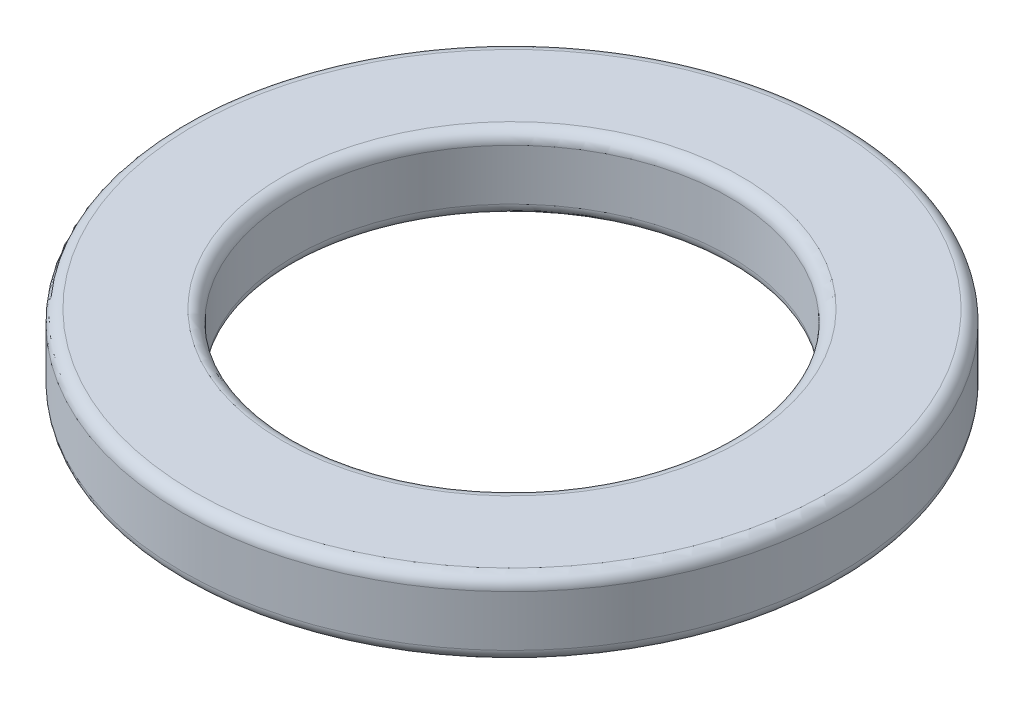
SolidWorks part; units mm, degrees
ref_plane "Face" through (0, 0, 0) normal (0, 0, 1) x (1, 0, 0)
ref_plane "Dessus" through (0, 0, 0) normal (0, 1, 0) x (1, 0, 0)
ref_plane "Profil" through (0, 0, 0) normal (1, 0, 0) x (0, 0, -1)
sketch "Esquisse1" plane through (0, 0, 0) normal (0, 0, 1) x (1, 0, 0)
  line L0 (0, 15.7889) -> (0, -5.894) construction
  line L1 (9, 5.6888) -> (9, -2.4194) construction
  line L3 (7.65, 0) -> (10.6, 0)
  line L4 (7.25, 0.4) -> (7.25, 2.1)
  line L5 (7.65, 2.5) -> (10.6, 2.5)
  line L6 (11, 0.4) -> (11, 2.1)
  arc A0 (7.65, 2.5) -> (7.25, 2.1) centre (7.65, 2.1) ccw
  arc A1 (11, 2.1) -> (10.6, 2.5) centre (10.6, 2.1) ccw
  arc A2 (10.6, 0) -> (11, 0.4) centre (10.6, 0.4) ccw
  arc A3 (7.25, 0.4) -> (7.65, 0) centre (7.65, 0.4) ccw
  dimension "D4" = 0.4
  dimension "D2" = 14.5
  dimension "D1" = 22
  dimension "D3" = 2.5
revolve "Base-Révolution" add sketch "Esquisse1" angle 360 about L0
